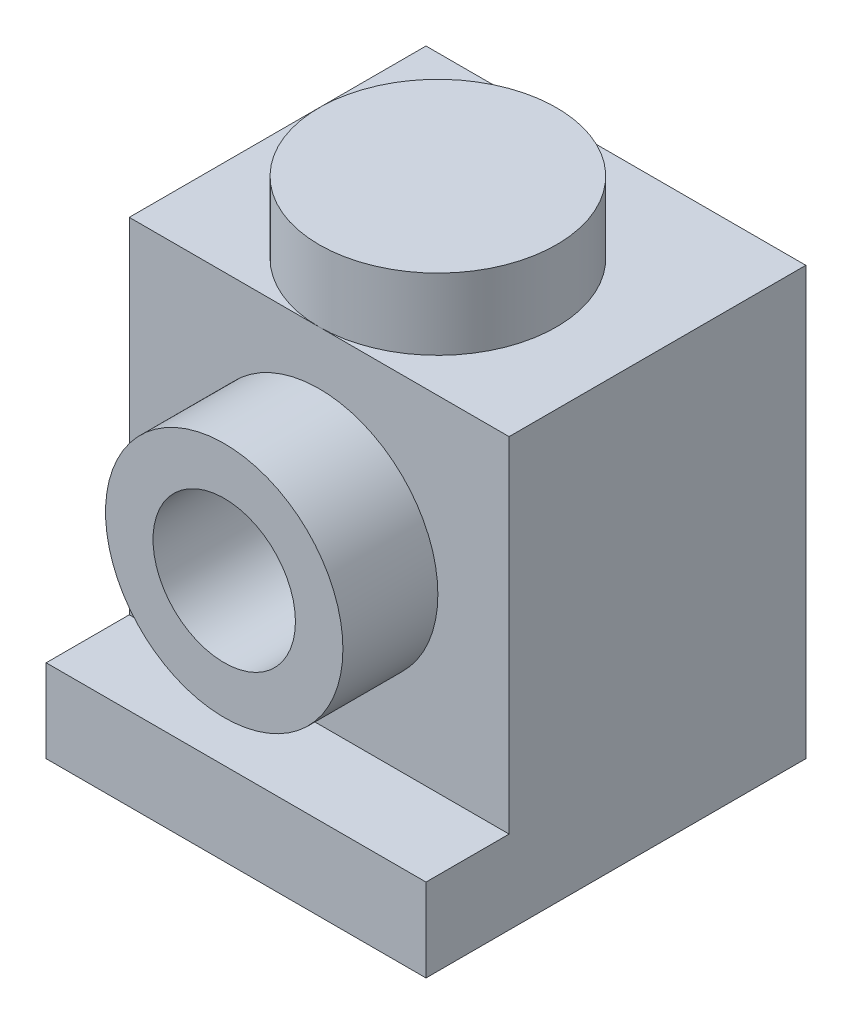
SolidWorks part; units mm, degrees
ref_plane "Face" through (0, 0, 0) normal (0, 0, 1) x (1, 0, 0)
ref_plane "Dessus" through (0, 0, 0) normal (0, 1, 0) x (1, 0, 0)
ref_plane "Droite" through (0, 0, 0) normal (1, 0, 0) x (0, 0, -1)
sketch "Esquisse2" plane through (0, 0, 0) normal (1, 0, 0) x (0, 0, -1)
  line L0 (0, 0) -> (8, 0)
  line L1 (8, 0) -> (8, 9)
  line L2 (8, 9) -> (1.75, 9)
  line L3 (1.75, 9) -> (1.75, 1.75)
  line L4 (1.75, 1.75) -> (0, 1.75)
  line L5 (0, 1.75) -> (0, 0)
  dimension "D1" = 6.25
  dimension "D2" = 1.75
  dimension "D3" = 1.75
  dimension "D4" = 9
extrude "Extrusion1" add sketch "Esquisse2" against normal blind 8
sketch "Esquisse3" plane through (0, 9, 0) normal (0, 1, 0) x (-1, 0, 0)
  line L0 (8, -1.75) -> (0, -1.75) construction
  line L1 (0, -8) -> (0, -1.75) construction
  circle A0 centre (4, -4.25) radius 2.5
  dimension "D2" = 5
  dimension "D1" = 4
extrude "Extrusion2" add sketch "Esquisse3" along normal blind 1.5
sketch "Esquisse4" plane through (0, 0, -8) normal (0, 0, -1) x (-1, 0, 0)
  line L0 (8, 9) -> (0, 9) construction
  line L1 (1.5, 7.5) -> (6.5, 7.5)
  line L2 (1.5, 7.5) -> (1.5, 2.5)
  line L3 (1.5, 2.5) -> (6.5, 2.5)
  line L4 (6.5, 7.5) -> (6.5, 2.5)
  line L5 (8, 0) -> (8, 9) construction
  dimension "D1" = 1.5
  dimension "D2" = 5
  dimension "D3" = 1.5
  dimension "D4" = 5
extrude "Enlèv. mat.-Extru.1" cut sketch "Esquisse4" against normal blind 5.75
sketch "Esquisse5" plane through (0, 0, -1.75) normal (0, 0, 1) x (1, 0, 0)
  line L0 (-8, 9) -> (-8, 1.75) construction
  line L1 (-8, 9) -> (-4, 9) construction
  circle A0 centre (-4, 5.375) radius 1.5
  circle A1 centre (-4, 5.375) radius 2.5
  dimension "D1" = 3
  dimension "D2" = 5
  dimension "D3" = 4
  dimension "D4" = 3.625
extrude "Extrusion3" add sketch "Esquisse5" along normal blind 2
sketch "Esquisse6" plane through (0, 0, -1.75) normal (0, 0, 1) x (1, 0, 0)
  line L0 (-4, 10.5) -> (-4, 9) construction
  line L1 (-8, 9) -> (-4, 9) construction
  circle A0 centre (-4, 5.375) radius 1.5
  dimension "D2" = 3
  dimension "D1" = 3.625
extrude "Enlèv. mat.-Extru.2" cut sketch "Esquisse6" against normal blind 2
sketch "Esquisse7" plane through (0, 0, 0) normal (0, -1, 0) x (1, 0, 0)
  line L1 (-1.5, -1.5) -> (-6.5, -1.5)
  line L2 (-1.5, -1.5) -> (-1.5, -6.5)
  line L3 (-1.5, -6.5) -> (-6.5, -6.5)
  line L4 (-6.5, -1.5) -> (-6.5, -6.5)
  line L7 (-8, 0) -> (-8, -8) construction
  line L9 (-8, 0) -> (0, 0) construction
  line L10 (-8, -8) -> (0, -8) construction
  dimension "D1" = 1.5
  dimension "D2" = 5
  dimension "D3" = 1.5
  dimension "D4" = 1.5
extrude "Enlèv. mat.-Extru.3" cut sketch "Esquisse7" against normal blind 1
sketch "Esquisse8" plane through (0, 1, 0) normal (0, -1, 0) x (1, 0, 0)
  line L0 (-4, 0.25) -> (-4, -1.75) construction
  line L1 (-1.5, -6) -> (-6.5, -6)
  line L2 (-1.5, -6.5) -> (-1.5, -1.5) construction
  line L3 (-6.5, -1.5) -> (-6.5, -6.5) construction
  line L4 (-6.5, -6.5) -> (-1.5, -6.5) construction
  line L5 (-1.5, -2) -> (-6.5, -2)
  arc A0 (-1.5, -2) -> (-6.5, -2) centre (-4, -8) ccw
  arc A1 (-6.5, -6) -> (-1.5, -6) centre (-4, 0) ccw
  dimension "D1" = 0.5
extrude "Enlèv. mat.-Extru.4" cut sketch "Esquisse8" against normal blind 0.25
sketch "Esquisse9" plane through (0, 1, 0) normal (0, -1, 0) x (1, 0, 0)
  line L0 (-1.5, -6.5) -> (-1.5, -1.5) construction
  line L1 (-1.5, -2.0141) -> (-6.5, -2.0141)
  line L2 (-1.5, -2.0141) -> (-1.5, -6)
  line L3 (-1.5, -6) -> (-6.5, -6)
  line L4 (-6.5, -2.0141) -> (-6.5, -6)
extrude "Enlèv. mat.-Extru.5" cut sketch "Esquisse9" against normal up to vertex
